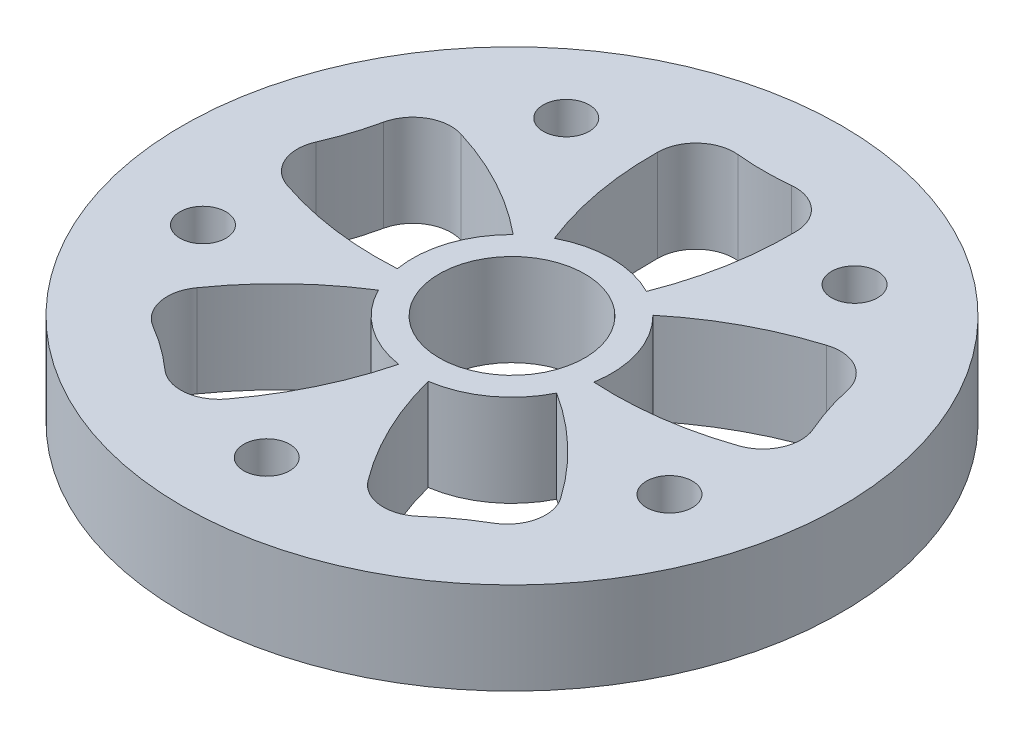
SolidWorks part; units mm, degrees
ref_plane "前视基准面" through (0, 0, 0) normal (0, 0, 1) x (1, 0, 0)
ref_plane "上视基准面" through (0, 0, 0) normal (0, 1, 0) x (1, 0, 0)
ref_plane "右视基准面" through (0, 0, 0) normal (1, 0, 0) x (0, 0, -1)
other "Configuration Table"
sketch "草图1" plane through (0, 0, 0) normal (0, 1, 0) x (1, 0, 0)
  line L0 (0, -56.3519) -> (0, 56.3519) construction
  line L1 (-75.1692, 0) -> (75.1692, 0) construction
  circle A0 centre (0, 0) radius 43
  circle A1 centre (0, 0) radius 32 construction
  circle A2 centre (0, 0) radius 9.5
  circle A3 centre (0, -32) radius 3
  circle A4 centre (-30.4338, -9.8885) radius 3
  circle A5 centre (-18.8091, 25.8885) radius 3
  circle A6 centre (18.8091, 25.8885) radius 3
  circle A7 centre (30.4338, -9.8885) radius 3
  point P10 (0, 0)
  point P11 (0, 0)
  point P13 (-16.1231, 16.2851)
  point P14 (0, 0)
  point P15 (0, 0)
  point P24 (0, 0)
  dimension "D1" = 86
  dimension "D2" = 64
  dimension "D3" = 19
  dimension "D4" = 6
  dimension "D5" = 5
extrude "凸台-拉伸1" add sketch "草图1" along normal mid plane 12
sketch "草图2" plane through (0, 0, 0) normal (0, 1, 0) x (1, 0, 0)
  line L0 (-65.9994, 0) -> (65.9994, 0) construction
  line L1 (0, -46.1829) -> (0, 46.1829) construction
  arc A0 (-9.114, 9.2701) -> (-12.8222, -2.1426) centre (0, 0) ccw
  arc A1 (-6, 11.5326) -> (-9, 28) centre (33.9947, 27.3257) cw
  arc A2 (-9, 28) -> (-3.5, 32.9749) centre (-4, 28) cw
  arc A3 (6, 11.5326) -> (9, 28) centre (-33.9947, 27.3257) ccw
  arc A4 (9, 28) -> (3.5, 32.9749) centre (4, 28) ccw
  arc A5 (-3.5, 32.9749) -> (3.5, 32.9749) centre (0, 67.7995) ccw
  arc A6 (9.114, 9.2701) -> (23.8484, 17.212) centre (36.4932, -23.8868) cw
  arc A7 (23.8484, 17.212) -> (30.2795, 13.5185) centre (25.3935, 12.4567) cw
  arc A8 (30.2795, 13.5185) -> (32.4426, 6.8611) centre (64.4812, 20.9512) ccw
  arc A9 (29.4107, 0.093) -> (32.4426, 6.8611) centre (27.8657, 4.8482) ccw
  arc A10 (12.8222, -2.1426) -> (29.4107, 0.093) centre (15.4833, 40.775) ccw
  arc A11 (11.6328, -5.8033) -> (23.7391, -17.3624) centre (-11.4407, -42.0885) cw
  arc A12 (23.7391, -17.3624) -> (22.2137, -24.62) centre (19.6941, -20.3013) cw
  arc A13 (22.2137, -24.62) -> (16.5506, -28.7345) centre (39.8515, -54.8509) ccw
  arc A14 (9.1768, -27.9425) -> (16.5506, -28.7345) centre (13.2219, -25.0036) ccw
  arc A15 (1.9246, -12.8568) -> (9.1768, -27.9425) centre (43.5639, -2.1254) ccw
  arc A16 (-1.9246, -12.8568) -> (-9.1768, -27.9425) centre (-43.5639, -2.1254) cw
  arc A17 (-9.1768, -27.9425) -> (-16.5506, -28.7345) centre (-13.2219, -25.0036) cw
  arc A18 (-16.5506, -28.7345) -> (-22.2137, -24.62) centre (-39.8515, -54.8509) ccw
  arc A19 (-23.7391, -17.3624) -> (-22.2137, -24.62) centre (-19.6941, -20.3013) ccw
  arc A20 (-11.6328, -5.8033) -> (-23.7391, -17.3624) centre (11.4407, -42.0885) ccw
  arc A21 (-12.8222, -2.1426) -> (-29.4107, 0.093) centre (-15.4833, 40.775) cw
  arc A22 (-29.4107, 0.093) -> (-32.4426, 6.8611) centre (-27.8657, 4.8482) cw
  arc A23 (-32.4426, 6.8611) -> (-30.2795, 13.5185) centre (-64.4812, 20.9512) ccw
  arc A24 (-23.8484, 17.212) -> (-30.2795, 13.5185) centre (-25.3935, 12.4567) ccw
  arc A25 (-9.114, 9.2701) -> (-23.8484, 17.212) centre (-36.4932, -23.8868) ccw
  arc A26 (6, 11.5326) -> (-6, 11.5326) centre (0, 0) ccw
  arc A27 (12.8222, -2.1426) -> (9.114, 9.2701) centre (0, 0) ccw
  arc A28 (-11.6328, -5.8033) -> (-1.9246, -12.8568) centre (0, 0) ccw
  arc A29 (1.9246, -12.8568) -> (11.6328, -5.8033) centre (0, 0) ccw
  point P3 (-9, 9.2701)
  point P4 (0, 0)
  point P8 (0, 0)
  point P18 (-9, 9.2701)
  point P19 (-9, 9.2701)
  point P20 (0, 0)
  point P69 (-9, 9.2701)
  point P70 (-13.2219, -2.1426)
  point P71 (0, 0)
  point P72 (0, 0)
  dimension "D1" = 26
  dimension "D2" = 43
  dimension "D3" = 5
  dimension "D4" = 28
  dimension "D5" = 8
  dimension "D6" = 12
  dimension "D7" = 7
  dimension "D8" = 5
extrude "切除-拉伸1" cut sketch "草图2" against normal through all both and the other way through all
